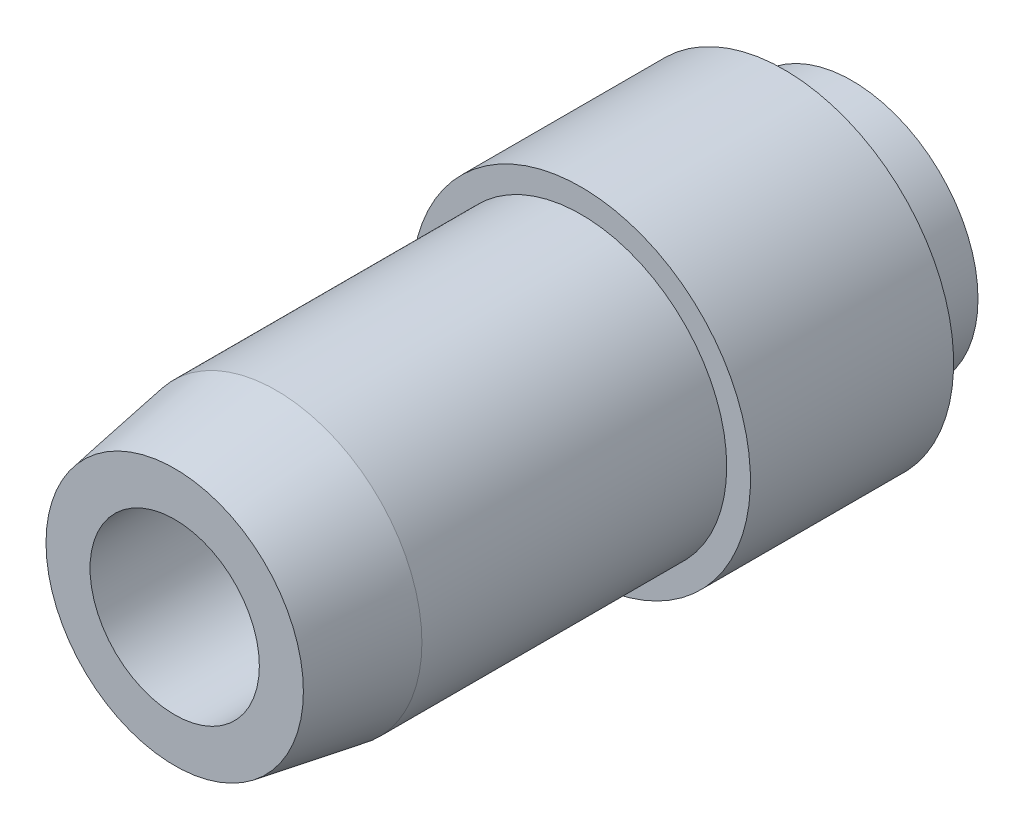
SolidWorks part; units mm, degrees
ref_plane "Front Plane" through (0, 0, 0) normal (0, 0, 1) x (1, 0, 0)
ref_plane "Top Plane" through (0, 0, 0) normal (0, 1, 0) x (1, 0, 0)
ref_plane "Right Plane" through (0, 0, 0) normal (1, 0, 0) x (0, 0, -1)
sketch "Sketch1" plane through (0, 0, 0) normal (0, 0, 1) x (1, 0, 0)
  circle A0 centre (0, 0) radius 4.7244
  dimension "D1" = 9.4488
extrude "inset" add sketch "Sketch1" along normal blind 2.54
sketch "Sketch2" plane through (0, 0, 2.54) normal (0, 0, 1) x (1, 0, 0)
  circle A0 centre (0, 0) radius 6.35
  dimension "D1" = 12.7
extrude "base" add sketch "Sketch2" along normal blind 7.62
sketch "Sketch3" plane through (0, 0, 10.16) normal (0, 0, 1) x (1, 0, 0)
  circle A0 centre (0, 0) radius 5.461
  dimension "D1" = 10.922
extrude "nib" add sketch "Sketch3" along normal blind 15.24
sketch "Sketch4" plane through (0, 0, 25.4) normal (0, 0, 1) x (1, 0, 0)
  circle A0 centre (0, 0) radius 3.175
  dimension "D1" = 6.35
extrude "Cut-Extrude1" cut sketch "Sketch4" against normal through all
chamfer "Chamfer1" distance 3.81 distance2 0.635 1 edges at (5.461, 0, 25.4)
